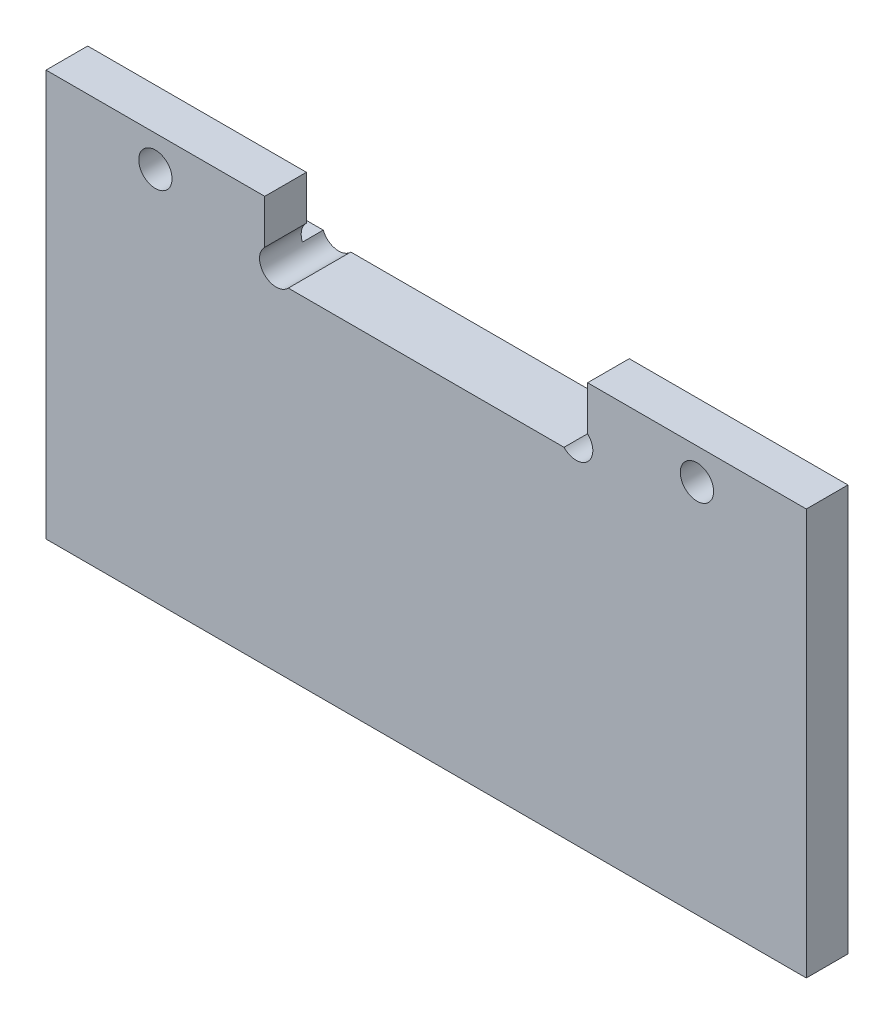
SolidWorks part; units mm, degrees
ref_plane "Plan de face" through (0, 0, 0) normal (0, 0, 1) x (1, 0, 0)
ref_plane "Plan de dessus" through (0, 0, 0) normal (0, 1, 0) x (1, 0, 0)
ref_plane "Plan de droite" through (0, 0, 0) normal (1, 0, 0) x (0, 0, -1)
sketch "Esquisse1" plane through (0, 0, 0) normal (0, 0, 1) x (1, 0, 0)
  line L1 (-40, 40) -> (33, 40)
  line L2 (-40, 40) -> (-40, 1)
  line L3 (-40, 1) -> (33, 1)
  line L4 (33, 40) -> (33, 1)
  dimension "D1" = 73
  dimension "D2" = 39
extrude "Extrusion1" add sketch "Esquisse1" along normal blind 6
sketch "Esquisse2" plane through (0, 0, 6) normal (0, 0, 1) x (1, 0, 0)
  line L0 (33, 40) -> (-40, 40) construction
  line L1 (-19, 40) -> (12, 40)
  line L2 (-19, 40) -> (-19, 33.5)
  line L3 (-19, 33.5) -> (12, 33.5)
  line L4 (12, 40) -> (12, 33.5)
  line L5 (-40, 40) -> (-40, 1) construction
  line L6 (33, 1) -> (33, 40) construction
  dimension "D1" = 21
  dimension "D2" = 21
  dimension "D3" = 6.5
  dimension "D4" = 31
extrude "Enlèv. mat.-Extru.1" cut sketch "Esquisse2" against normal blind 6
sketch "Esquisse3" plane through (0, 0, 0) normal (0, 0, -1) x (-1, 0, 0)
  line L1 (-33, 40) -> (-10, 40)
  line L2 (-33, 40) -> (-33, 34)
  line L3 (-33, 34) -> (-10, 34)
  line L4 (-10, 40) -> (-10, 34)
  line L6 (40, 40) -> (10, 40)
  line L7 (40, 40) -> (40, 34)
  line L8 (40, 34) -> (10, 34)
  line L9 (10, 40) -> (10, 34)
  dimension "D1" = 6
  dimension "D2" = 6
extrude "Enlèv. mat.-Extru.2" cut sketch "Esquisse3" against normal blind 2
sketch "Esquisse4" plane through (0, 0, 6) normal (0, 0, 1) x (1, 0, 0)
  line L0 (33, 1) -> (33, 40) construction
  line L1 (-40, 40) -> (-40, 1) construction
  line L2 (-19, 40) -> (-40, 40) construction
  line L3 (33, 40) -> (12, 40) construction
  line L4 (-19, 33.5) -> (12, 33.5) construction
  line L5 (-19, 40) -> (-19, 33.5) construction
  line L6 (12, 33.5) -> (12, 40) construction
  circle A0 centre (22.5, 37) radius 1.6
  circle A1 centre (-29.5, 37) radius 1.6
  circle A2 centre (-17.9, 34.6) radius 1.6
  circle A3 centre (10.9, 34.6) radius 1.6
  dimension "D1" = 10.5
  dimension "D5" = 1.1
  dimension "D7" = 1.1
  dimension "D2" = 10.5
  dimension "D3" = 3
  dimension "D4" = 3
  dimension "D6" = 1.1
  dimension "D8" = 1.1
extrude "Enlèv. mat.-Extru.3" cut sketch "Esquisse4" against normal through all
sketch "Esquisse5" plane through (0, 0, 0) normal (0, 0, -1) x (-1, 0, 0)
  line L0 (-33, 1) -> (-33, 34) construction
  line L1 (40, 1) -> (-33, 1)
  line L2 (40, 1) -> (40, 4.2)
  line L3 (-29.8, 4.2) -> (36.8, 4.2)
  line L4 (-33, 1) -> (-33, 4)
  line L5 (-33, 40) -> (-12, 40) construction
  line L7 (-33, 4) -> (-33, 34)
  line L8 (-33, 34) -> (-29.8, 34)
  line L9 (-29.8, 4.2) -> (-29.8, 34)
  line L10 (19, 40) -> (40, 40) construction
  line L12 (40, 4.2) -> (40, 34)
  line L13 (40, 34) -> (36.8, 34)
  line L14 (36.8, 4.2) -> (36.8, 34)
  dimension "D1" = 3.2
  dimension "D2" = 3.2
  dimension "D3" = 6
  dimension "D4" = 6
  dimension "D5" = 3.2
  dimension "D6" = 3.2
extrude "Enlèv. mat.-Extru.4" cut sketch "Esquisse5" against normal blind 2
